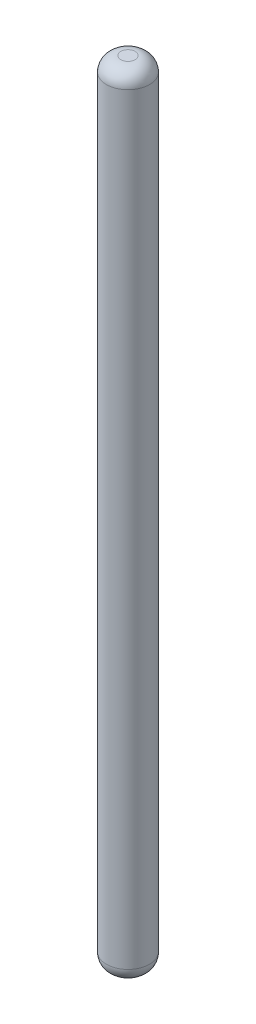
SolidWorks part; units mm, degrees
ref_plane "Front Plane" through (0, 0, 0) normal (0, 0, 1) x (1, 0, 0)
ref_plane "Top Plane" through (0, 0, 0) normal (0, 1, 0) x (1, 0, 0)
ref_plane "Right Plane" through (0, 0, 0) normal (1, 0, 0) x (0, 0, -1)
sketch "Sketch1" plane through (0, 0, 0) normal (0, 1, 0) x (1, 0, 0)
  circle A0 centre (0, 0) radius 1.5
  dimension "D1" = 3
extrude "Boss-Extrude1" add sketch "Sketch1" along normal blind 55
fillet "Fillet1" radius 1 2 edges at (0, 0, 1.5) (0, 55, 1.5)
